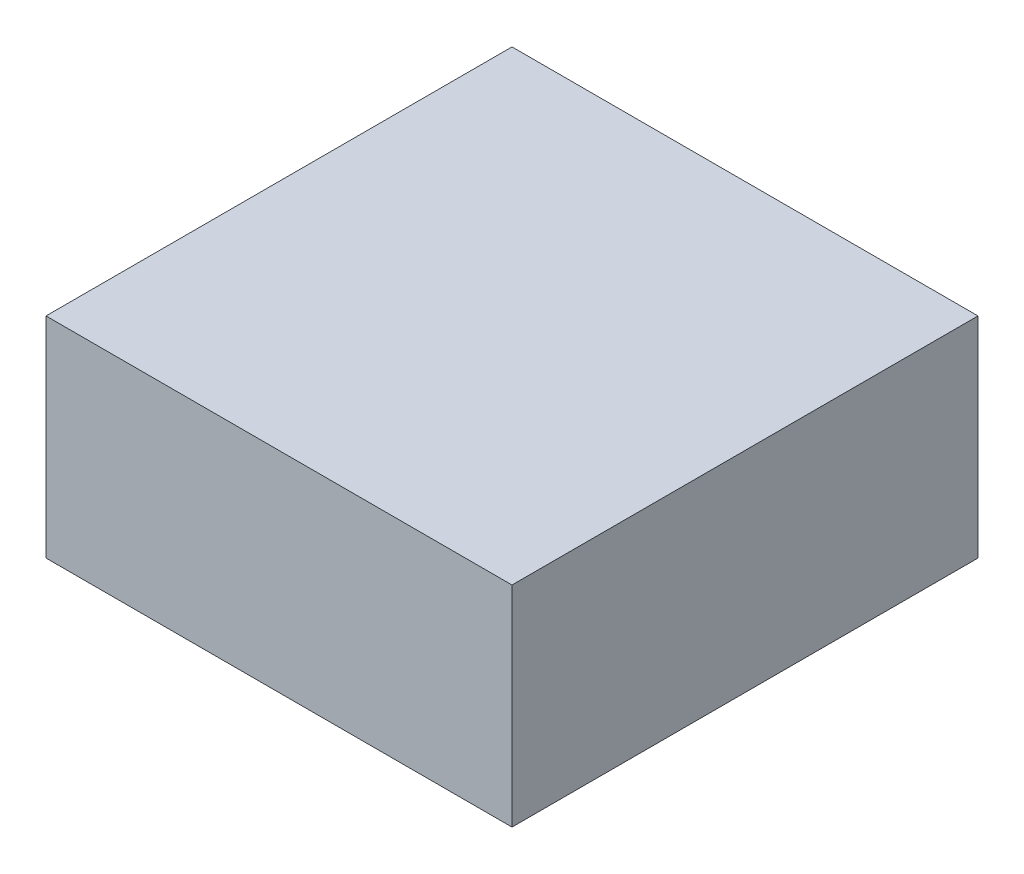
SolidWorks part; units mm, degrees
ref_plane "Face" through (0, 0, 0) normal (0, 0, 1) x (1, 0, 0)
ref_plane "Dessus" through (0, 0, 0) normal (0, 1, 0) x (1, 0, 0)
ref_plane "Droite" through (0, 0, 0) normal (1, 0, 0) x (0, 0, -1)
sketch "Esquisse1" plane through (0, 0, 0) normal (0, 0, 1) x (1, 0, 0)
  line L1 (-50, 25) -> (50, 25)
  line L2 (-50, 25) -> (-50, -20)
  line L3 (-50, -20) -> (50, -20)
  line L4 (50, 25) -> (50, -20)
  dimension "D1" = 45
  dimension "D2" = 50
  dimension "D3" = 100
  dimension "D4" = 20
extrude "Extrusion1" add sketch "Esquisse1" along normal blind 100
sketch "Esquisse2" plane through (0, -20, 0) normal (0, -1, 0) x (1, 0, 0)
  line L0 (211.6102, 50) -> (-52.9432, 50) construction
  line L1 (0, 117.224) -> (0, -15.8307) construction
  line L2 (-50, 100) -> (-50, 0) construction
  line L3 (50, 100) -> (50, 0) construction
  line L4 (-50, 100) -> (50, 100) construction
  line L5 (-50, 0) -> (50, 0) construction
  circle A0 centre (0, 50) radius 22
  dimension "D1" = 44
extrude "Enlèv. mat.-Extru.1" cut sketch "Esquisse2" against normal blind 17 draft 12
sketch "Esquisse3" plane through (0, -20, 0) normal (0, -1, 0) x (1, 0, 0)
  line L0 (-60, 50) -> (60, 50)
  line L1 (60, 50) -> (60, 115)
  line L2 (60, 115) -> (-60, 115)
  line L3 (-60, 115) -> (-60, 50)
  line L6 (-60.0111, 50) -> (64.7045, 50) construction
  line L7 (-50, 100) -> (50, 100) construction
  line L8 (-50, 0) -> (50, 0) construction
  line L9 (-50, 100) -> (-50, 0) construction
  dimension "D1" = 10
  dimension "D2" = 120
  dimension "D3" = 65
extrude "Enlèv. mat.-Extru.2" cut sketch "Esquisse3" against normal through all
